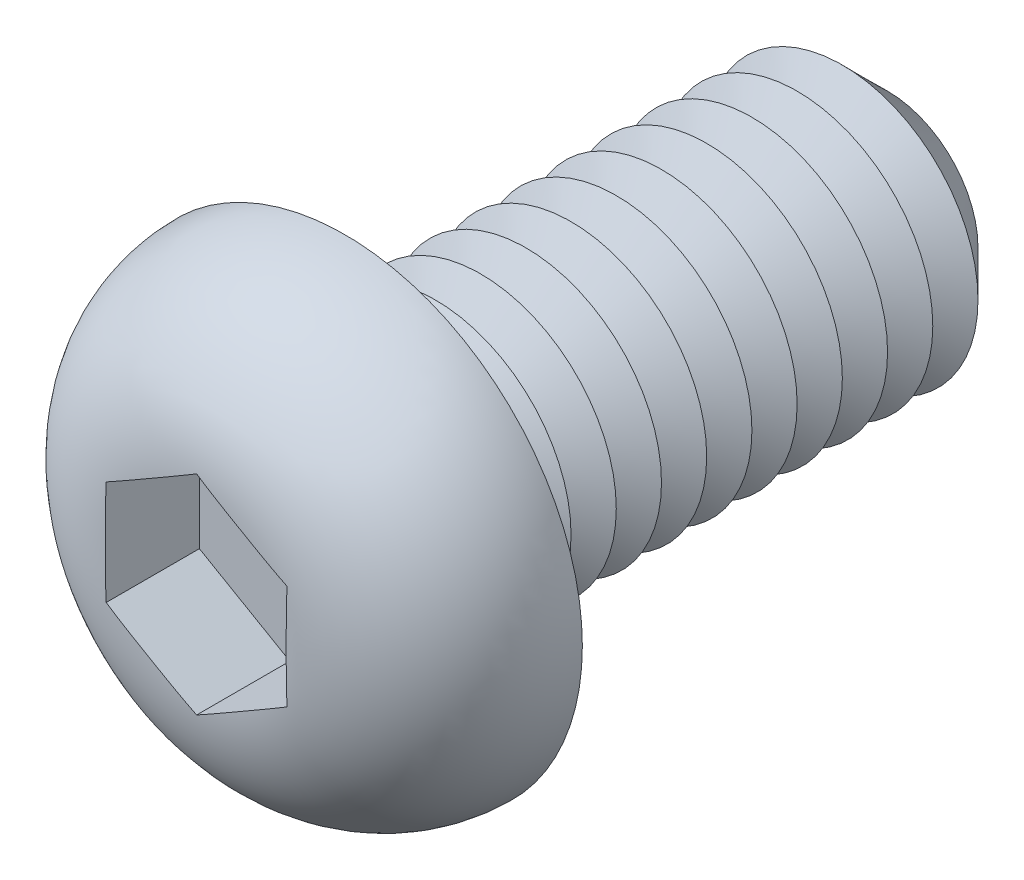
SolidWorks part; units mm, degrees
ref_plane "Front Plane" through (0, 0, 0) normal (0, 0, 1) x (1, 0, 0)
ref_plane "Top Plane" through (0, 0, 0) normal (0, 1, 0) x (1, 0, 0)
ref_plane "Right Plane" through (0, 0, 0) normal (1, 0, 0) x (0, 0, -1)
sketch "Sketch1" plane through (0, 0, 0) normal (1, 0, 0) x (0, 0, -1)
  line L0 (-47.9342, 0) -> (60.3146, 0) construction
sketch "Sketch2" plane through (0, 0, 0) normal (1, 0, 0) x (0, 0, -1)
  line L0 (0, 0) -> (-3.3, 0)
  line L1 (-47.9342, 0) -> (60.3146, 0) construction
  line L2 (-3.3, 0) -> (-3.3, 1.95)
  line L3 (0, 5.25) -> (0, 0)
  arc A0 (-3.3, 1.95) -> (0, 5.25) centre (0, 1.95) cw
  dimension "D1" = 3.3
  dimension "D2" = 3.3
  dimension "D3" = 5.25
revolve "Revolve1" add sketch "Sketch2" angle 360 about L0
sketch "Sketch3" plane through (0, 0, 3.3) normal (0, 0, 1) x (1, 0, 0)
  line L1 (0, 2.3094) -> (-2, 1.1547)
  line L2 (-2, 1.1547) -> (-2, -1.1547)
  line L3 (-2, -1.1547) -> (0, -2.3094)
  line L4 (0, -2.3094) -> (2, -1.1547)
  line L5 (2, -1.1547) -> (2, 1.1547)
  line L6 (2, 1.1547) -> (0, 2.3094)
  circle A0 centre (0, 0) radius 2 construction
  dimension "D1" = 4
extrude "Cut-Extrude1" cut sketch "Sketch3" against normal blind 2.08
sketch "Sketch4" plane through (0, 0, 0) normal (0, 0, -1) x (-1, 0, 0)
  circle A0 centre (0, 0) radius 3
  dimension "D1" = 6
extrude "Boss-Extrude1" add sketch "Sketch4" along normal blind 12
chamfer "Chamfer1" distance 1 angle 45 1 edges at (-3, 0, -12)
sketch "Sketch5" plane through (0, 0, 0) normal (1, 0, 0) x (0, 0, -1)
  line L0 (1, 3) -> (2, 3)
  line L1 (11, 3) -> (0, 3) construction
  line L2 (2, 3) -> (1.5, 2.134)
  line L3 (1.5, 2.134) -> (1, 3)
  line L4 (0, -5.25) -> (0, 5.25) construction
  line L5 (11, 3) -> (0, 3) construction
  dimension "D1" = 1
  dimension "D2" = 1
revolve "Cut-Revolve1" cut sketch "Sketch5" angle 360 about L0
pattern_linear "LPattern1" count 10 spacing 1 along (0, 0, -1) of "Cut-Revolve1"
fillet "Fillet2" radius 0.5 1 edges at (3, 0, 0)
sketch "Sketch6" plane through (0, 0, 1.22) normal (0, 0, 1) x (1, 0, 0)
  circle A0 centre (0, 0) radius 0.8
  dimension "D1" = 1.6
extrude "Cut-Extrude2" cut sketch "Sketch6" against normal up to surface (13.22 mm away)
